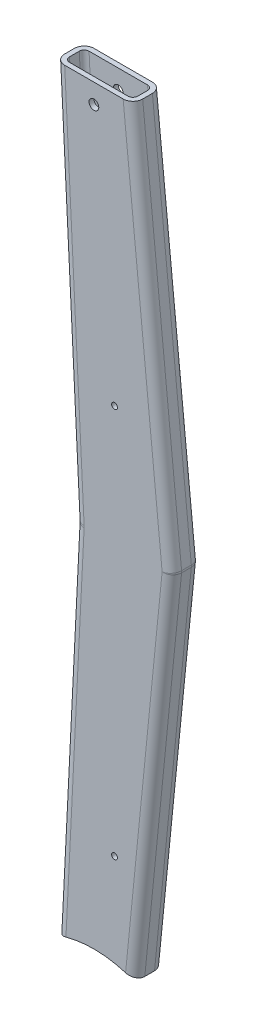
SolidWorks part; units mm, degrees
ref_plane "Front Plane" through (0, 0, 0) normal (0, 0, 1) x (1, 0, 0)
ref_plane "Top Plane" through (0, 0, 0) normal (0, 1, 0) x (1, 0, 0)
ref_plane "Right Plane" through (0, 0, 0) normal (1, 0, 0) x (0, 0, -1)
sketch "Sketch1" plane through (0, 0, 0) normal (0, 0, 1) x (1, 0, 0)
  line L0 (0, 400) -> (20, 400) construction
  line L1 (0, 0) -> (120, 0) construction
  line L2 (0, 0) -> (0, 800) construction
  line L3 (0, 800) -> (120, 800) construction
  line L4 (120, 0) -> (120, 800) construction
  line L5 (0, 0) -> (20, 400)
  line L6 (20, 400) -> (0, 800)
  line L7 (0, 800) -> (80, 800)
  line L8 (80, 800) -> (120, 400)
  line L9 (120, 400) -> (80, 0)
  line L10 (80, 0) -> (0, 0)
  dimension "D1" = 800
  dimension "D2" = 120
  dimension "D3" = 20
  dimension "D4" = 80
  dimension "D5" = 80
extrude "Extrude1" add sketch "Sketch1" along normal blind 30
sketch "Sketch2" plane through (0, 0, 0) normal (0, 0, 1) x (1, 0, 0)
  line L0 (40, 0) -> (40, -80) construction
  line L1 (0, 0) -> (80, 0) construction
  circle A0 centre (40, -80) radius 110
  dimension "D2" = 220
  dimension "D1" = 80
extrude "Extrude2" cut sketch "Sketch2" along normal through all
fillet "Fillet1" radius 10 10 edges at (120, 400, 15) (100, 600, 30) (10.5727, 211.4547, 30) (10.5727, 211.4547, 0) (20, 400, 15) (10, 600, 0) (10, 600, 30) (101.08, 210.7999, 0) (101.08, 210.7999, 30) (100, 600, 0)
shell "Shell1" thickness 5
sketch "Sketch3" plane through (0, 0, 30) normal (0, 0, 1) x (1, 0, 0)
  circle A0 centre (61.1455, 122.9093) radius 3
  circle A1 centre (61.1455, 522.9093) radius 3
  dimension "D1" = 6
  dimension "D2" = 6
  dimension "D3" = 100
  dimension "D4" = 60
  dimension "D5" = 400
extrude "Extrude4" [suppressed] cut sketch "Sketch3" against normal through all
sketch "Sketch4" plane through (0, 0, 0) normal (0, 0, -1) x (-1, 0, 0)
  circle A0 centre (-61.1455, 122.9093) radius 3
  circle A1 centre (-61.1455, 522.9093) radius 3
  dimension "D2" = 6
  dimension "D4" = 6
  dimension "D1" = 100
  dimension "D3" = 60
  dimension "D5" = 400
extrude "Extrude5" cut sketch "Sketch4" against normal through all
sketch "Sketch5" plane through (0, 0, 30) normal (0, 0, 1) x (1, 0, 0)
  line L0 (69.9501, 800) -> (10.0125, 800) construction
  circle A0 centre (39.9813, 780) radius 5
  point P2 (39.9813, 800)
  dimension "D2" = 10
  dimension "D1" = 20
extrude "Extrude6" cut sketch "Sketch5" against normal through all
